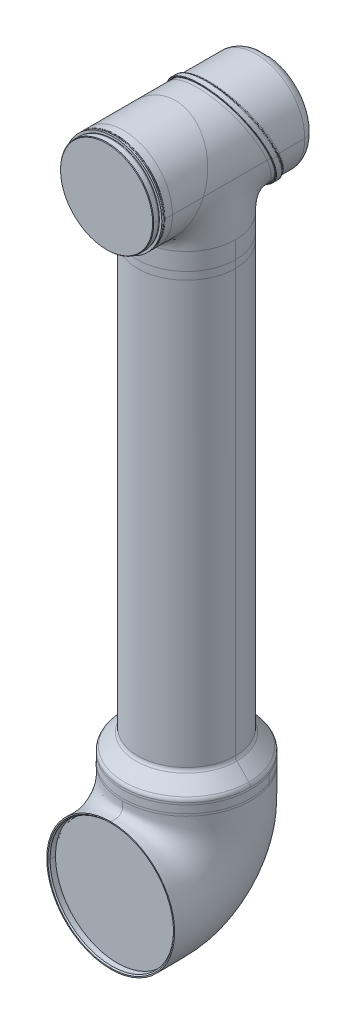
SolidWorks part; units mm, degrees
ref_plane "前视基准面" through (0, 0, 0) normal (0, 0, 1) x (1, 0, 0)
ref_plane "上视基准面" through (0, 0, 0) normal (0, 1, 0) x (1, 0, 0)
ref_plane "右视基准面" through (0, 0, 0) normal (1, 0, 0) x (0, 0, -1)
imported_body "输入1"
chamfer "倒角1" distance 0.5 angle 45
ref_plane "基准面1" through (0, 80.9289, 0) normal (0, 1, 0) x (1, 0, 0)
ref_plane "基准面2" through (0, 78.9989, 0) normal (0, 1, 0) x (1, 0, 0)
ref_plane "基准面3" through (0, 71.9989, 0) normal (0, 1, 0) x (1, 0, 0)
ref_plane "基准面4" through (-0.0002, 511.4999, 0.0002) normal (0, -1, 0) x (-1, 0, 0)
ref_plane "基准面5" through (-0.0002, 495.4999, 0.0002) normal (0, -1, 0) x (-1, 0, 0)
ref_plane "基准面6" through (-0.0002, 488.4999, 0.0002) normal (0, -1, 0) x (-1, 0, 0)
ref_plane "基准面7" through (0, 0, -12) normal (0, 0, 1) x (1, 0, 0)
ref_plane "基准面8" through (0, 0, -5) normal (0, 0, 1) x (1, 0, 0)
ref_plane "基准面9" through (0, 122.3631, -288.2694) normal (0, -0.3907, 0.9205) x (1, 0, 0)
split "分割1" trim tools "基准面2", "基准面3" bodies to split 109 resulting bodies 110 111 112
split "分割2" trim tools "基准面5", "基准面6" bodies to split 111 resulting bodies 113 114 115
split "分割3" trim tools "基准面8", "基准面7", "基准面9" bodies to split 115 resulting bodies 116 117 118 119
